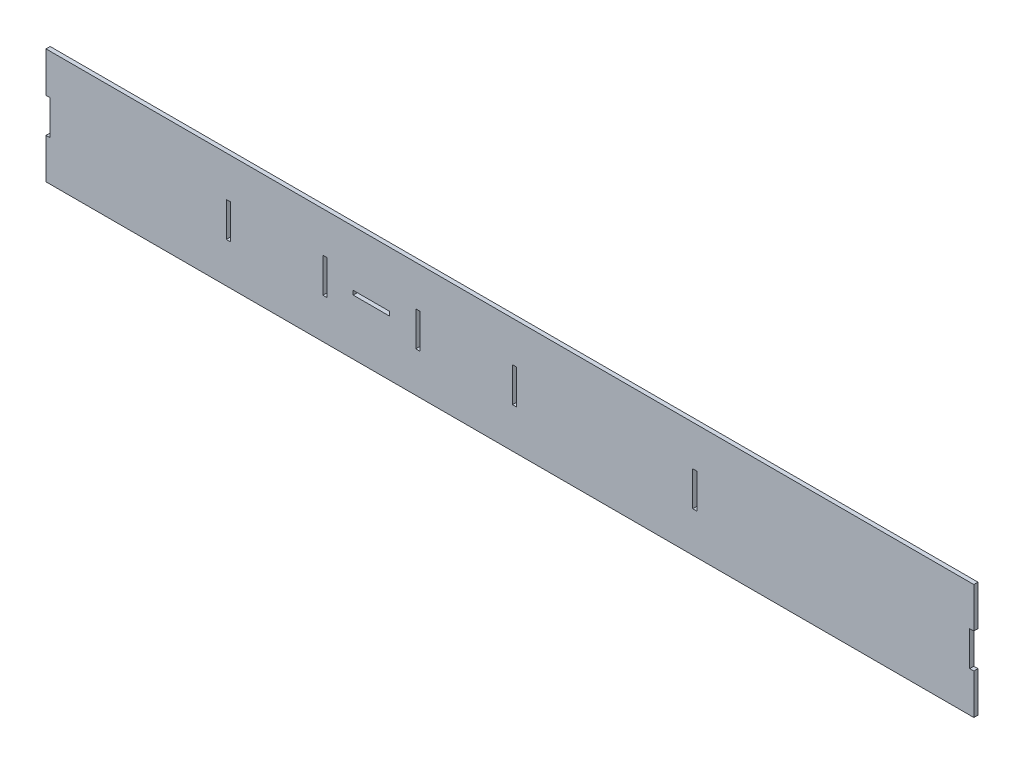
SolidWorks part; units mm, degrees
ref_plane "Front Plane" through (0, 0, 0) normal (0, 0, 1) x (1, 0, 0)
ref_plane "Top Plane" through (0, 0, 0) normal (0, 1, 0) x (1, 0, 0)
ref_plane "Right Plane" through (0, 0, 0) normal (1, 0, 0) x (0, 0, -1)
sketch "Sketch1" plane through (0, 0, 0) normal (0, 0, 1) x (1, 0, 0)
  line L0 (-1.524, -7.869) -> (0, -7.869)
  line L1 (-1.524, -22.6446) -> (338.8496, -22.6446)
  line L2 (-1.524, -22.6446) -> (-1.524, -7.869)
  line L3 (-1.524, 19.6067) -> (338.8496, 19.6067)
  line L4 (338.8496, -22.6446) -> (338.8496, 19.6067)
  line L5 (0, -7.869) -> (0, 4.831)
  line L6 (0, 4.831) -> (-1.524, 4.831)
  line L7 (-1.524, 4.831) -> (-1.524, 19.6067)
  line L9 (101.6, 4.831) -> (100.076, 4.831)
  line L10 (101.6, 4.831) -> (101.6, -7.869)
  line L11 (101.6, -7.869) -> (100.076, -7.869)
  line L12 (100.076, 4.831) -> (100.076, -7.869)
  line L13 (134.1256, -7.869) -> (135.6496, -7.869)
  line L14 (134.1256, -7.869) -> (134.1256, 4.831)
  line L15 (134.1256, 4.831) -> (135.6496, 4.831)
  line L16 (135.6496, -7.869) -> (135.6496, 4.831)
  line L17 (235.7256, -7.869) -> (237.2496, -7.869)
  line L18 (235.7256, -7.869) -> (235.7256, 4.831)
  line L19 (235.7256, 4.831) -> (237.2496, 4.831)
  line L20 (237.2496, -7.869) -> (237.2496, 4.831)
  line L21 (338.8496, -7.869) -> (337.3256, -7.869)
  line L22 (338.8496, -7.869) -> (338.8496, 4.831)
  line L23 (338.8496, 4.831) -> (337.3256, 4.831)
  line L24 (337.3256, -7.869) -> (337.3256, 4.831)
extrude "Boss-Extrude1" add sketch "Sketch1" along normal blind 1.524 contours L21 L24 L23 L4 L3 L7 L6 L5 L0 L2 L1 L12 L9 L10 L11 L16 L13 L14 L15 L20 L17 L18 L19
sketch "Sketch2" plane through (0, 0, 1.524) normal (0, 0, 1) x (1, 0, 0)
  line L0 (101.6, -1.519) -> (134.1256, -1.519) construction
  line L1 (66.1281, -7.869) -> (64.6041, -7.869)
  line L2 (66.1281, -7.869) -> (66.1281, 4.831)
  line L3 (66.1281, 4.831) -> (64.6041, 4.831)
  line L4 (64.6041, -7.869) -> (64.6041, 4.831)
  line L5 (101.6, 4.831) -> (101.6, -7.869) construction
  line L6 (134.1256, -7.869) -> (134.1256, 4.831) construction
  line L7 (117.8628, -1.519) -> (117.8628, -74.1573) construction
  line L8 (171.1214, -7.869) -> (171.1214, 4.831)
  line L9 (169.5974, 4.831) -> (171.1214, 4.831)
  line L10 (169.5974, -7.869) -> (169.5974, 4.831)
  line L11 (169.5974, -7.869) -> (171.1214, -7.869)
  line L13 (111.1599, -2.281) -> (124.5657, -2.281)
  line L14 (111.1599, -2.281) -> (111.1599, -0.757)
  line L15 (111.1599, -0.757) -> (124.5657, -0.757)
  line L16 (124.5657, -2.281) -> (124.5657, -0.757)
  line L17 (111.1599, -2.281) -> (124.5657, -0.757) construction
  line L18 (111.1599, -0.757) -> (124.5657, -2.281) construction
  dimension "D1" = 1.524
extrude "Cut-Extrude1" cut sketch "Sketch2" against normal blind 2.54
